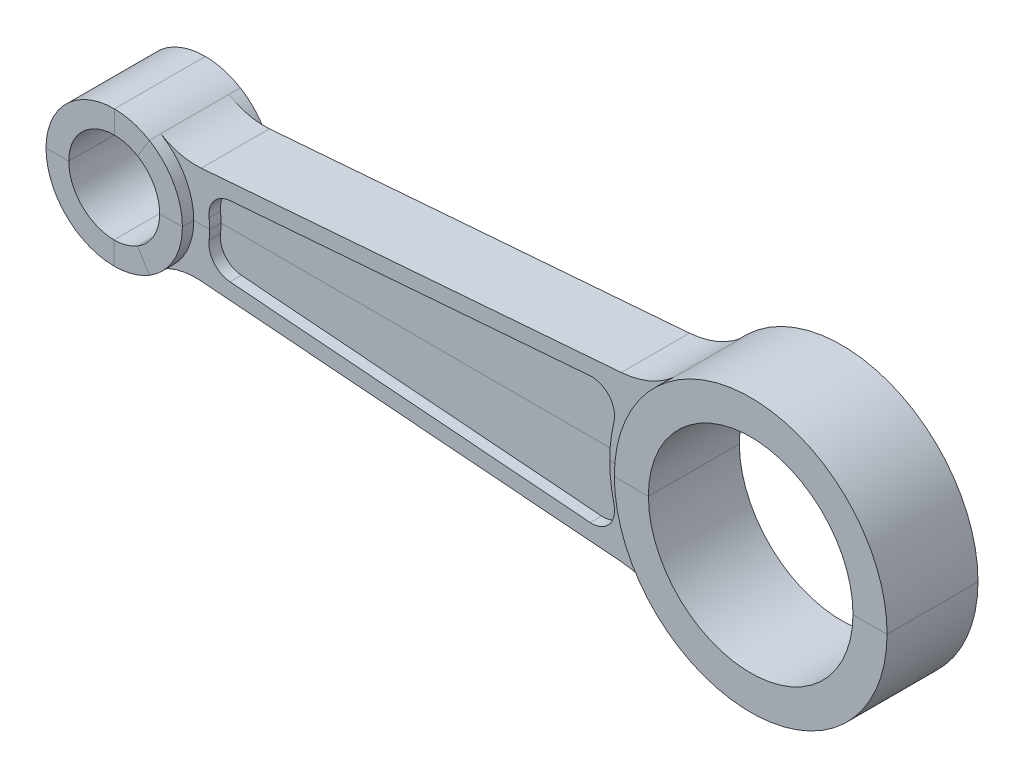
SolidWorks part; units mm, degrees
ref_plane "Front Plane" through (0, 0, 0) normal (0, 0, 1) x (1, 0, 0)
ref_plane "Top Plane" through (0, 0, 0) normal (0, 1, 0) x (1, 0, 0)
ref_plane "Right Plane" through (0, 0, 0) normal (1, 0, 0) x (0, 0, -1)
sketch "Sketch1" plane through (0, 0, 0) normal (0, 1, 0) x (1, 0, 0)
  line L0 (38.1, 25.4) -> (0, 25.4)
  line L1 (0, 25.4) -> (0, 19.05)
  line L2 (0, 19.05) -> (38.1, 19.05)
  line L3 (38.1, 19.05) -> (38.1, 25.4)
  line L4 (0, 25.4) -> (0, 19.05) construction
revolve "Revolve1" add sketch "Sketch1" angle 360 about L4
sketch "Sketch2" plane through (0, 0, -19.05) normal (0, 0, 1) x (1, 0, 0)
  line L0 (295.8347, -47.271) -> (42.2666, -27.3147)
  line L1 (42.2666, 27.3147) -> (295.8347, 47.271)
  arc A0 (295.8347, 47.271) -> (295.8347, -47.271) centre (355.6, 0) cw
  arc A1 (42.2666, -27.3147) -> (19.6386, -32.6486) centre (39.2773, -65.2973) ccw
  arc A2 (19.6386, -32.6486) -> (19.6386, 32.6486) centre (0, 0) cw
  arc A3 (19.6386, 32.6486) -> (42.2666, 27.3147) centre (39.2773, 65.2973) ccw
extrude "Boss-Extrude1" add sketch "Sketch2" along normal blind 44.45
sketch "Sketch3" plane through (0, 0, 25.4) normal (0, 0, 1) x (1, 0, 0)
  line L0 (42.2666, -27.3147) -> (295.8347, -47.271)
  line L1 (295.8347, 47.271) -> (42.2666, 27.3147)
  arc A0 (295.8347, -47.271) -> (295.8347, 47.271) centre (355.6, 0) cw
  arc A1 (42.2666, 27.3147) -> (19.6386, 32.6486) centre (39.2773, 65.2973) cw
  arc A2 (19.6386, 32.6486) -> (19.6386, -32.6486) centre (0, 0) cw
  arc A3 (19.6386, -32.6486) -> (42.2666, -27.3147) centre (39.2773, -65.2973) cw
extrude "Cut-Extrude1" cut sketch "Sketch3" against normal blind 6.35
sketch "Sketch4" plane through (0, 0, -19.05) normal (0, 0, -1) x (-1, 0, 0)
  circle A0 centre (-355.6, 0) radius 76.2
extrude "Boss-Extrude2" add sketch "Sketch4" along normal blind 6.35
sketch "Sketch5" plane through (0, 0, -19.05) normal (0, 0, -1) x (-1, 0, 0)
  line L0 (-43.2073, 18.4713) -> (-259.5169, 35.4952)
  line L1 (-259.5169, -35.4952) -> (-43.2073, -18.4713)
  arc A0 (-43.2073, -18.4713) -> (-43.2073, 18.4713) centre (0, 0) cw
  arc A1 (-259.5169, 35.4952) -> (-272.8622, 19.8689) centre (-260.5133, 22.8344) ccw
  arc A2 (-272.8622, 19.8689) -> (-272.8622, -19.8689) centre (-355.6, 0) cw
  arc A3 (-272.8622, -19.8689) -> (-259.5169, -35.4952) centre (-260.5133, -22.8344) ccw
extrude "Cut-Extrude2" cut sketch "Sketch5" against normal blind 6.35
sketch "Sketch6" plane through (0, 0, 19.05) normal (0, 0, 1) x (1, 0, 0)
  line L0 (259.5169, 35.4952) -> (43.2073, 18.4713)
  line L1 (43.2073, -18.4713) -> (259.5169, -35.4952)
  arc A0 (43.2073, 18.4713) -> (43.2073, -18.4713) centre (0, 0) cw
  arc A1 (259.5169, -35.4952) -> (272.8622, -19.8689) centre (260.5133, -22.8344) ccw
  arc A2 (272.8622, -19.8689) -> (272.8622, 19.8689) centre (355.6, 0) cw
  arc A3 (272.8622, 19.8689) -> (259.5169, 35.4952) centre (260.5133, 22.8344) ccw
extrude "Cut-Extrude3" cut sketch "Sketch6" against normal blind 6.35
hole_wizard "Hole1" positions "Sketch8" profile "Sketch7" legacy
sketch "Sketch8" plane through (0, 0, 25.4) normal (0, 0, 1) x (1, 0, 0)
  point P0 (355.6, 0)
sketch "Sketch7" plane through (355.6, 0, 25.4) normal (1, 0, 0) x (0, -1, 0)
  line L0 (0, 0) -> (0, 50.8)
  line L1 (0, 50.8) -> (57.15, 50.8)
  line L2 (57.15, 50.8) -> (57.15, 0)
  line L3 (57.15, 0) -> (0, 0)
  line L4 (0, 110) -> (0, -10) construction
  dimension "Diameter" = 114.3
  dimension "Depth" = 50.8
hole_wizard "Hole2" positions "Sketch10" profile "Sketch9" legacy
sketch "Sketch10" plane through (0, 0, 25.4) normal (0, 0, 1) x (1, 0, 0)
  point P0 (0, 0)
sketch "Sketch9" plane through (0, 0, 25.4) normal (1, 0, 0) x (0, -1, 0)
  line L0 (0, 0) -> (0, 50.8)
  line L1 (0, 50.8) -> (25.4, 50.8)
  line L2 (25.4, 50.8) -> (25.4, 0)
  line L3 (25.4, 0) -> (0, 0)
  line L4 (0, 110) -> (0, -10) construction
  dimension "Diameter" = 50.8
  dimension "Depth" = 50.8
fillet "Fillet1" radius 12.7 4 edges at (43.2073, 18.4713, 15.875) (43.2073, -18.4713, 15.875) (43.2073, 18.4713, -15.875) (43.2073, -18.4713, -15.875)
fillet "Fillet2" radius 50.8 2 edges at (295.8347, -47.271, 0) (295.8347, 47.271, 0)
sketch "Sketch11" plane through (0, 0, 25.4) normal (0, 0, 1) x (1, 0, 0)
  line L0 (0, 0) -> (0.2425, 70.8754)
  line L1 (0, 0) -> (-0.1925, -56.2477)
  point P0 (0, 0)
sketch "Sketch12" plane through (0, 0, 25.4) normal (0, 0, 1) x (1, 0, 0)
  line L0 (0, 0) -> (26.9831, 44.8586)
  line L1 (0, 0) -> (34.612, -57.5414)
  line L2 (0, 0) -> (0.15, 44.3977) construction
  line L3 (0, 0) -> (-0.203, -60.1108) construction
  arc A0 (42.2666, -27.3147) -> (19.6386, -32.6486) centre (39.2773, -65.2973) ccw construction
  arc A1 (19.6386, 32.6486) -> (42.2666, 27.3147) centre (39.2773, 65.2973) ccw construction
  arc A2 (42.2666, -27.3147) -> (19.6386, -32.6486) centre (39.2773, -65.2973) ccw construction
  arc A3 (19.6386, 32.6486) -> (42.2666, 27.3147) centre (39.2773, 65.2973) ccw construction
  point P0 (0, 0)
sketch "Sketch13" plane through (0, 0, 25.4) normal (0, 0, 1) x (1, 0, 0)
  line L0 (0, 0) -> (482.0192, -0.3451)
  line L1 (0, 0) -> (-73.6443, 0.0527)
  point P0 (0, 0)
